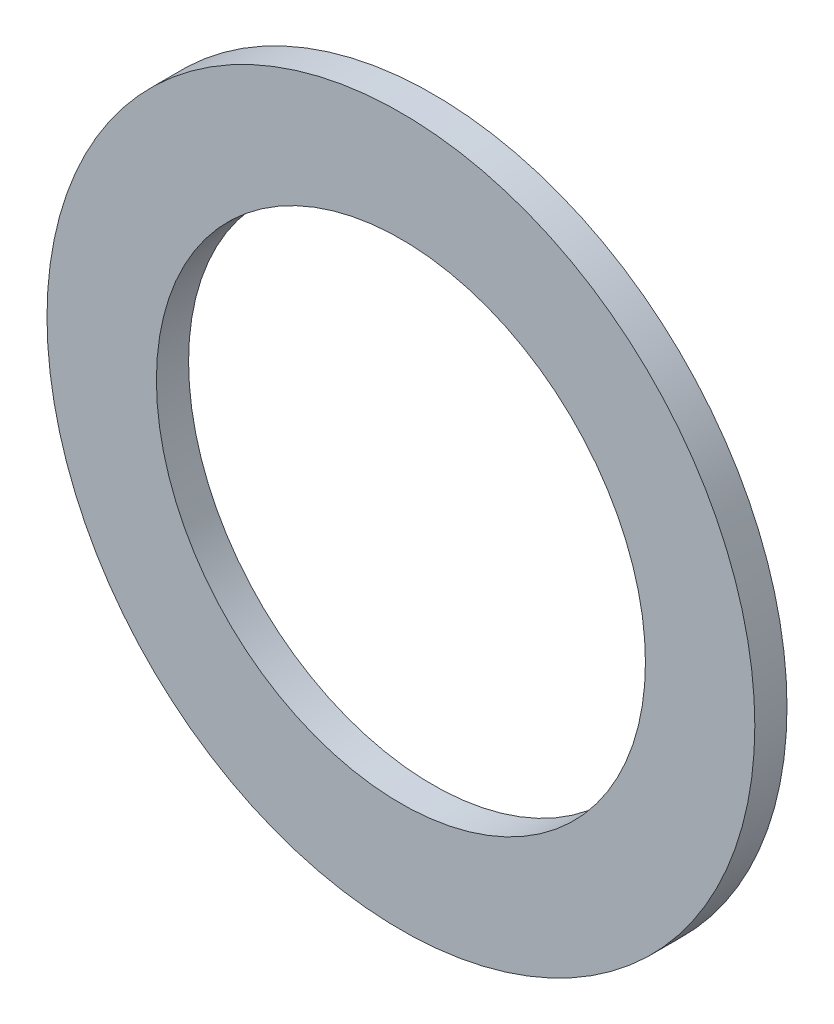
SolidWorks part; units mm, degrees
ref_plane "Face" through (0, 0, 0) normal (0, 0, 1) x (1, 0, 0)
ref_plane "Dessus" through (0, 0, 0) normal (0, 1, 0) x (1, 0, 0)
ref_plane "Droite" through (0, 0, 0) normal (1, 0, 0) x (0, 0, -1)
sketch "Esquisse1" plane through (0, 0, 0) normal (0, 0, 1) x (1, 0, 0)
  circle A0 centre (0, 0) radius 55
  circle A1 centre (0, 0) radius 38
  dimension "D1" = 110
  dimension "D2" = 76
extrude "Extrusion1" add sketch "Esquisse1" along normal blind 5
